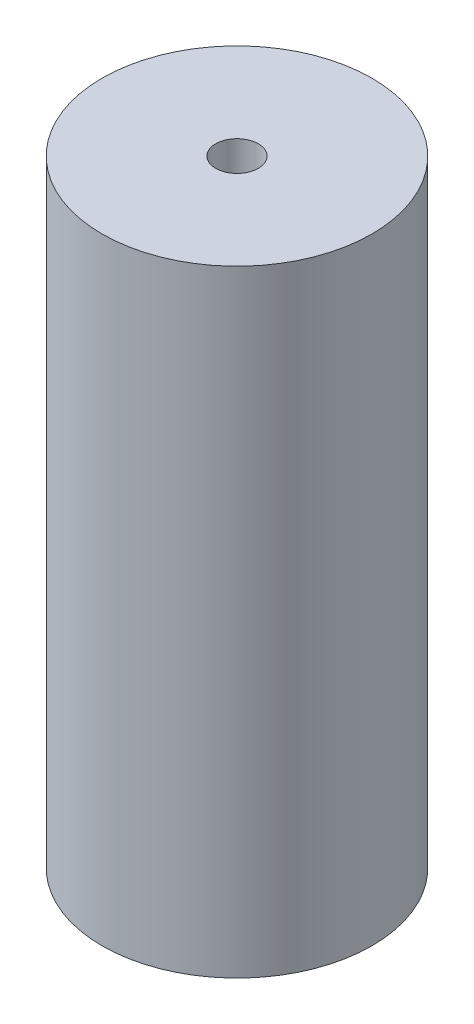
SolidWorks part; units mm, degrees
ref_plane "Front" through (0, 0, 0) normal (0, 0, 1) x (1, 0, 0)
ref_plane "Top" through (0, 0, 0) normal (0, 1, 0) x (1, 0, 0)
ref_plane "Right" through (0, 0, 0) normal (1, 0, 0) x (0, 0, -1)
ref_axis "Axis1" through (0, -50, 0) along (0, 1, 0)
sketch "Sketch1" plane through (0, 0, 0) normal (1, 0, 0) x (0, 0, -1)
  line L5 (0, 21.7) -> (-9.5, 21.7) construction
  line L6 (0, 21.7) -> (0, -21.7) construction
  line L11 (0, -21.7) -> (-9.5, -21.7) construction
  line L12 (-9.5, 21.7) -> (-9.5, -21.7) construction
  line L13 (0, 21.7) -> (-9.5, -21.7) construction
  line L14 (0, -21.7) -> (-9.5, 21.7) construction
  line L15 (0, 21.7) -> (-1.5, 21.7) construction
  line L16 (0, 21.7) -> (0, -21.7) construction
  line L17 (0, -21.7) -> (-1.5, -21.7) construction
  line L18 (-1.5, 21.7) -> (-1.5, -21.7) construction
  line L19 (0, 21.7) -> (-1.5, -21.7) construction
  line L20 (0, -21.7) -> (-1.5, 21.7) construction
  point P4 (-4.75, 0)
  point P5 (0, 0)
  point P8 (-0.75, 0)
  dimension "D1" = 9.5
  dimension "D2" = 43.4
  dimension "D3" = 1.5
sketch "Sketch3" plane through (0, 0, 0) normal (1, 0, 0) x (0, 0, -1)
  line L0 (-9.5, 21.7) -> (-9.5, -21.7) construction
  line L1 (0, -21.7) -> (-9.5, -21.7) construction
  line L2 (-1.5, 21.7) -> (-1.5, -21.7) construction
  line L3 (0, 21.7) -> (-9.5, 21.7) construction
  line L4 (-9.5, 21.7) -> (-9.5, -21.7)
  line L5 (-1.5, -21.7) -> (-9.5, -21.7)
  line L6 (-1.5, 21.7) -> (-1.5, -21.7)
  line L7 (-1.5, 21.7) -> (-9.5, 21.7)
revolve "Revolve1" add sketch "Sketch3" angle 360 about axis through (0, -50, 0) along (0, 1, 0)
ref_plane "Cap - Top" through (0, 5, 0) normal (0, 1, 0) x (1, 0, 0)
ref_plane "Cap - Bottom" through (0, -5, 0) normal (0, 1, 0) x (1, 0, 0)
